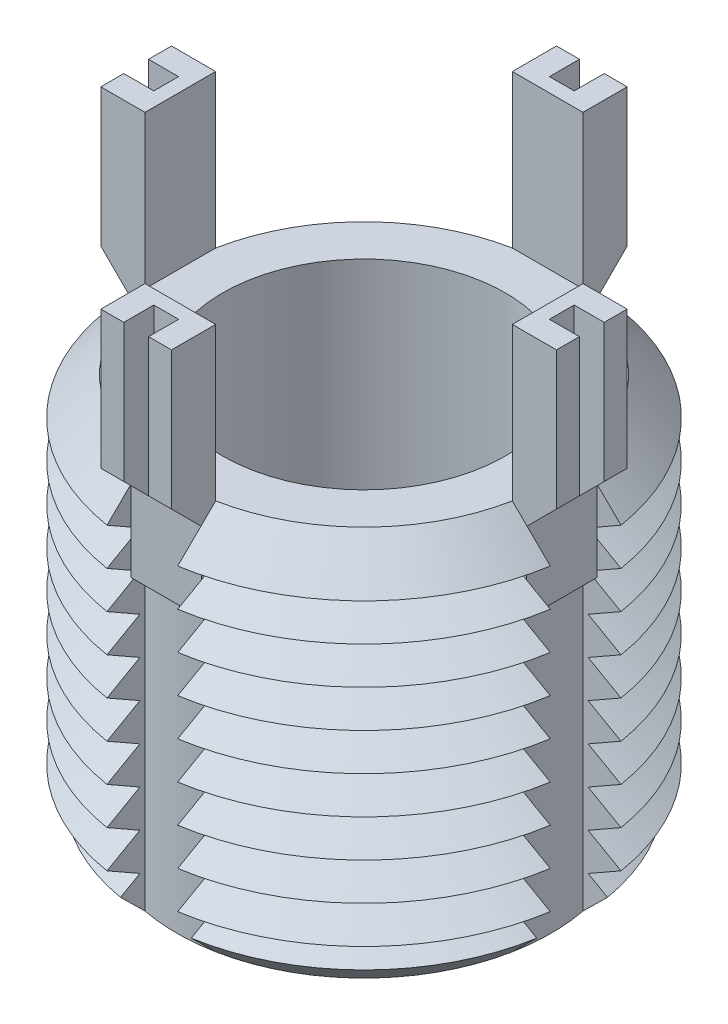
SolidWorks part; units mm, degrees
ref_plane "Front Plane" through (0, 0, 0) normal (0, 0, 1) x (1, 0, 0)
ref_plane "Top Plane" through (0, 0, 0) normal (0, 1, 0) x (1, 0, 0)
ref_plane "Right Plane" through (0, 0, 0) normal (1, 0, 0) x (0, 0, -1)
sketch "Sketch1" plane through (0, 0, 0) normal (0, 1, 0) x (1, 0, 0)
  circle A0 centre (0, 0) radius 12.7
  dimension "D1" = 25.4
extrude "Boss-Extrude1" add sketch "Sketch1" against normal blind 22.098
chamfer "Chamfer1" distance 2.117 angle 45 2 edges at (0, -22.098, 12.7) (0, 0, 12.7)
sketch "Sketch2" plane through (0, 0, 0) normal (1, 0, 0) x (0, 0, -1)
  line L0 (0, 0.8859) -> (0, -9.2617) construction
sketch "Sketch3" plane through (0, 0, 0) normal (1, 0, 0) x (0, 0, -1)
  line L0 (-12.7, -2.117) -> (-10.8666, -3.1755)
  line L1 (-10.8666, -3.1755) -> (-12.7, -4.234)
  line L2 (-12.7, -2.117) -> (-12.7, -19.981) construction
  line L3 (-12.7, -4.234) -> (-12.7, -2.117)
  dimension "D1" = 2.117
revolve "Cut-Revolve1" cut sketch "Sketch3" angle 360 about L0
pattern_linear "LPattern1" count 9 spacing 2.117 along (0, -1, 0) of "Cut-Revolve1"
sketch "Sketch4" plane through (0, 0, 0) normal (0, 1, 0) x (1, 0, 0)
  line L0 (-10.3923, 2) -> (-12.5415, 2)
  line L2 (-12.5415, -2) -> (-10.3923, -2)
  arc A0 (-10.3923, 2) -> (-10.3923, -2) centre (0, 0) ccw
  arc A1 (-12.5415, 2) -> (-12.5415, -2) centre (0, 0) ccw
  circle A2 centre (0, 0) radius 12.7 construction
  circle A3 centre (0, 0) radius 10.583 construction
  point P1 (-10.583, 0)
  point P3 (-12.7, 0)
  point P13 (0, 0)
  dimension "D1" = 4
extrude "Cut-Extrude1" cut sketch "Sketch4" against normal up to surface (22.098 mm away)
pattern_circular "CirPattern1" count 4 over 360 about axis through (0, 0, 0) along (0, 1, 0) of "Cut-Extrude1"
sketch "Sketch5" plane through (0, 0, 0) normal (1, 0, 0) x (0, 0, -1)
  line L0 (-10.3923, 8.649) -> (-10.3923, -5.351)
  line L1 (-10.3923, -5.351) -> (-11.1923, -5.351)
  line L2 (-11.1923, -5.351) -> (-11.1923, -0.851)
  line L3 (-11.1923, -0.851) -> (-12.8923, 0.849)
  line L4 (-12.8923, 0.849) -> (-12.8923, 8.649)
  line L5 (-12.8923, 8.649) -> (-10.3923, 8.649)
  line L6 (-12.5415, -6.351) -> (-2, -6.351) construction
  point P9 (-2, 0)
  point P10 (-11.1923, -0.851)
  dimension "D1" = 1
  dimension "D2" = 14
  dimension "D3" = 9.5
  dimension "D4" = 2.5
  dimension "D5" = 0.8
  dimension "D6" = 45
extrude "Boss-Extrude3" add sketch "Sketch5" along normal mid plane 4
pattern_circular "CirPattern2" count 4 over 360 about axis through (0, 0, 0) along (0, 1, 0) of "Boss-Extrude3"
sketch "Sketch6" plane through (0, 8.649, 0) normal (0, 1, 0) x (1, 0, 0)
  line L0 (-12.8923, -2) -> (-12.8923, 2) construction
  line L1 (-12.8923, -0.7) -> (-11.1923, -0.7)
  line L2 (-12.8923, -0.7) -> (-12.8923, 0.7)
  line L3 (-12.8923, 0.7) -> (-11.1923, 0.7)
  line L4 (-11.1923, -0.7) -> (-11.1923, 0.7)
  line L5 (-12.8923, -0.7) -> (-11.1923, 0.7) construction
  line L6 (-12.8923, 0.7) -> (-11.1923, -0.7) construction
  line L7 (12.8923, 2) -> (12.8923, -2) construction
  line L8 (-0.7, 11.1923) -> (0.7, 11.1923)
  line L9 (-0.7, 11.1923) -> (-0.7, 12.8923)
  line L10 (-0.7, 12.8923) -> (0.7, 12.8923)
  line L11 (0.7, 11.1923) -> (0.7, 12.8923)
  line L12 (-0.7, 11.1923) -> (0.7, 12.8923) construction
  line L13 (-0.7, 12.8923) -> (0.7, 11.1923) construction
  line L14 (11.1923, -0.7) -> (12.8923, -0.7)
  line L15 (11.1923, -0.7) -> (11.1923, 0.7)
  line L16 (11.1923, 0.7) -> (12.8923, 0.7)
  line L17 (12.8923, -0.7) -> (12.8923, 0.7)
  line L18 (11.1923, -0.7) -> (12.8923, 0.7) construction
  line L19 (11.1923, 0.7) -> (12.8923, -0.7) construction
  line L20 (-0.7, -12.8923) -> (0.7, -12.8923)
  line L21 (-0.7, -12.8923) -> (-0.7, -11.1923)
  line L22 (-0.7, -11.1923) -> (0.7, -11.1923)
  line L23 (0.7, -12.8923) -> (0.7, -11.1923)
  line L24 (-0.7, -12.8923) -> (0.7, -11.1923) construction
  line L25 (-0.7, -11.1923) -> (0.7, -12.8923) construction
  line L26 (-2, 12.8923) -> (2, 12.8923) construction
  line L27 (2, -12.8923) -> (-2, -12.8923) construction
  point P0 (-12.0423, 0)
  point P7 (-12.8923, 0)
  point P8 (-12.8923, 0)
  point P9 (0, 12.0423)
  point P14 (12.0423, 0)
  point P19 (0, -12.0423)
  point P24 (0, 12.8923)
  point P25 (12.8923, 0)
  point P26 (12.8923, 0)
  point P27 (0, 12.8923)
  point P30 (0, -12.8923)
  point P33 (0, -12.8923)
  dimension "D1" = 1.4
  dimension "D2" = 1.7
extrude "Cut-Extrude3" cut sketch "Sketch6" against normal up to surface (7.8 mm away)
sketch "Sketch7" plane through (0, 0, 0) normal (0, 1, 0) x (1, 0, 0)
  circle A0 centre (0, 0) radius 8
  dimension "D1" = 16
extrude "Cut-Extrude4" cut sketch "Sketch7" against normal up to surface (22.098 mm away)
